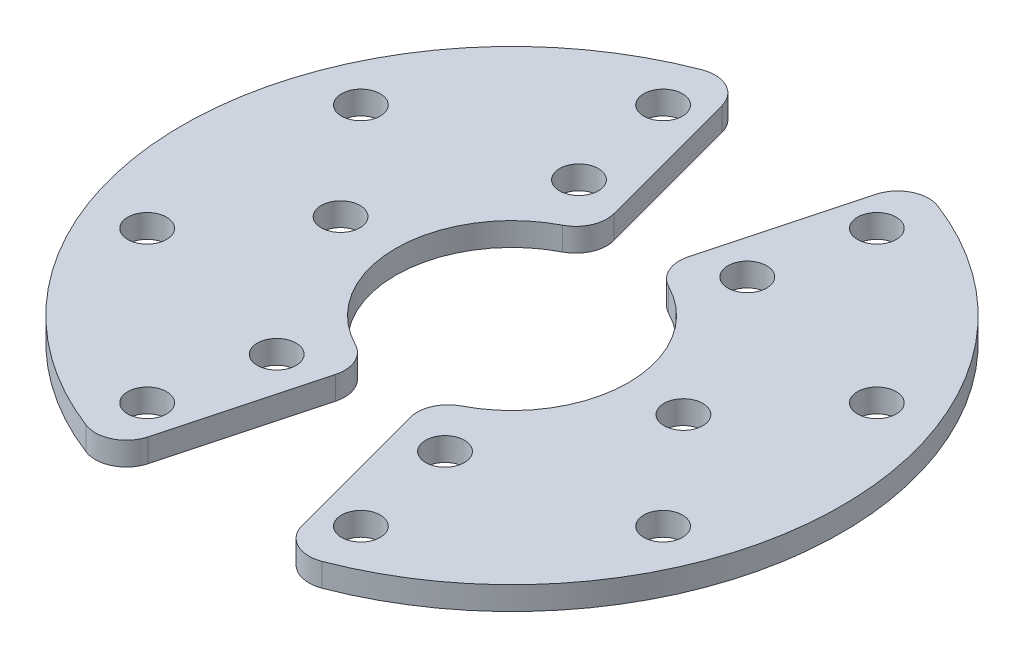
SolidWorks part; units mm, degrees
ref_plane "Front Plane" through (0, 0, 0) normal (0, 0, 1) x (1, 0, 0)
ref_plane "Top Plane" through (0, 0, 0) normal (0, 1, 0) x (1, 0, 0)
ref_plane "Right Plane" through (0, 0, 0) normal (1, 0, 0) x (0, 0, -1)
sketch "Sketch1" plane through (0, 0, 0) normal (0, 1, 0) x (1, 0, 0)
  line L0 (-13.7766, 33.2597) -> (0, 0) construction
  line L1 (0, 0) -> (0, 36) construction
  line L2 (-11.25, 19.4856) -> (-10.85, 19.4856) construction
  line L3 (-11.25, 21.9856) -> (-10.85, 21.9856)
  line L4 (-11.25, 16.9856) -> (-10.85, 16.9856)
  line L5 (-22.5, 0) -> (-22.1, 0) construction
  line L8 (-22.5, 2.5) -> (-22.1, 2.5)
  line L9 (-22.5, -2.5) -> (-22.1, -2.5)
  line L10 (-11.25, -19.4856) -> (-10.85, -19.4856) construction
  line L11 (-11.25, -16.9856) -> (-10.85, -16.9856)
  line L12 (-11.25, -21.9856) -> (-10.85, -21.9856)
  line L13 (0, -55) -> (0, 55) construction
  line L14 (11.25, -19.4856) -> (10.85, -19.4856) construction
  line L15 (11.25, -16.9856) -> (10.85, -16.9856)
  line L16 (11.25, -21.9856) -> (10.85, -21.9856)
  line L17 (22.5, 0) -> (22.1, 0) construction
  line L18 (22.5, 2.5) -> (22.1, 2.5)
  line L19 (22.5, -2.5) -> (22.1, -2.5)
  line L20 (11.25, 19.4856) -> (10.85, 19.4856) construction
  line L21 (11.25, 21.9856) -> (10.85, 21.9856)
  line L22 (11.25, 16.9856) -> (10.85, 16.9856)
  circle A0 centre (0, 0) radius 15
  circle A1 centre (0, 0) radius 42.5
  circle A2 centre (0, 0) radius 36 construction
  circle A3 centre (0, 0) radius 22.5 construction
  circle A4 centre (22.5, 0) radius 2.5 construction
  circle A5 centre (33.2597, -13.7766) radius 2.5
  circle A6 centre (11.25, -19.4856) radius 2.5 construction
  circle A7 centre (-11.25, -19.4856) radius 2.5 construction
  circle A8 centre (-22.5, 0) radius 2.5 construction
  circle A9 centre (-11.25, 19.4856) radius 2.5 construction
  circle A10 centre (11.25, 19.4856) radius 2.5 construction
  circle A11 centre (13.7766, -33.2597) radius 2.5
  circle A12 centre (-13.7766, -33.2597) radius 2.5
  circle A13 centre (-33.2597, -13.7766) radius 2.5
  circle A14 centre (-33.2597, 13.7766) radius 2.5
  circle A15 centre (-13.7766, 33.2597) radius 2.5
  circle A16 centre (13.7766, 33.2597) radius 2.5
  circle A17 centre (33.2597, 13.7766) radius 2.5
  arc A18 (-11.25, 21.9856) -> (-11.25, 16.9856) centre (-11.25, 19.4856) ccw
  arc A19 (-10.85, 16.9856) -> (-10.85, 21.9856) centre (-10.85, 19.4856) ccw
  arc A22 (-22.5, 2.5) -> (-22.5, -2.5) centre (-22.5, 0) ccw
  arc A23 (-22.1, -2.5) -> (-22.1, 2.5) centre (-22.1, 0) ccw
  arc A24 (-11.25, -16.9856) -> (-11.25, -21.9856) centre (-11.25, -19.4856) ccw
  arc A25 (-10.85, -21.9856) -> (-10.85, -16.9856) centre (-10.85, -19.4856) ccw
  arc A26 (11.25, -16.9856) -> (11.25, -21.9856) centre (11.25, -19.4856) cw
  arc A27 (10.85, -21.9856) -> (10.85, -16.9856) centre (10.85, -19.4856) cw
  arc A28 (22.5, 2.5) -> (22.5, -2.5) centre (22.5, 0) cw
  arc A29 (22.1, -2.5) -> (22.1, 2.5) centre (22.1, 0) cw
  arc A30 (11.25, 21.9856) -> (11.25, 16.9856) centre (11.25, 19.4856) cw
  arc A31 (10.85, 16.9856) -> (10.85, 21.9856) centre (10.85, 19.4856) cw
  circle A32 centre (-10.85, 19.4856) radius 2.5
  circle A33 centre (10.85, 19.4856) radius 2.5
  circle A34 centre (22.1, 0) radius 2.5
  circle A35 centre (10.85, -19.4856) radius 2.5
  circle A36 centre (-10.85, -19.4856) radius 2.5
  circle A37 centre (-22.1, 0) radius 2.5
  point P10 (-11.05, 19.4856)
  point P23 (0, 0)
  point P38 (0, 0)
  point P46 (-22.3, 0)
  point P56 (-11.05, -19.4856)
  point P67 (11.05, -19.4856)
  point P73 (22.3, 0)
  point P79 (11.05, 19.4856)
  dimension "D1" = 85
  dimension "D2" = 30
  dimension "D3" = 45
  dimension "D4" = 72
  dimension "D5" = 5
  dimension "D6" = 5
  dimension "D9" = 22.5
  dimension "D10" = 0.4
  dimension "D7" = 6
  dimension "D8" = 8
extrude "Boss-Extrude1" add sketch "Sketch1" along normal blind 3 contours A1 A25 L12 A24 L11 A23 L9 A22 L8 A19 L4 A18 L3 A17 A16 A15 A14 A13 A12 A11 A5 A0 L16 A27 L15 A26 L19 A29 L18 A28 L22 A31 L21 A30 | A37 L8 A22 L9 | A32 L3 A18 L4 | A33 L22 A30 L21 | A34 L19 A28 L18 | A35 L16 A26 L15 | A36 L11 A24 L12
sketch "Sketch2" plane through (0, 3, 0) normal (0, 1, 0) x (1, 0, 0)
  line L0 (-10.9998, 41.0518) -> (0, 0)
  line L1 (0, 0) -> (10.9998, 41.0518)
  line L3 (0, 0) -> (10.0775, 0) construction
  line L4 (0, 0) -> (10.9998, -41.0518)
  line L5 (-10.9998, -41.0518) -> (0, 0)
  circle A0 centre (0, 0) radius 42.5 construction
  arc A1 (-10.9998, -41.0518) -> (10.9998, -41.0518) centre (0, 0) ccw
  arc A2 (10.9998, 41.0518) -> (-10.9998, 41.0518) centre (0, 0) ccw
  dimension "D1" = 30
extrude "Cut-Extrude1" cut sketch "Sketch2" against normal blind 10
fillet "Fillet1" radius 4 4 edges at (-10.9998, 1.5, 41.0518) (-3.8823, 1.5, 14.4889) (-10.9998, 1.5, -41.0518) (-3.8823, 1.5, -14.4889)
fillet "Fillet2" radius 4 4 edges at (3.8823, 1.5, 14.4889) (10.9998, 1.5, 41.0518) (3.8823, 1.5, -14.4889) (10.9998, 1.5, -41.0518)
sketch "Sketch3" plane through (0, 3, 0) normal (0, 1, 0) x (1, 0, 0)
  line L2 (14.85, 13) -> (14.85, 7) construction
  line L3 (14.85, 13) -> (14.85, 7)
  line L4 (0, 0) -> (73.1548, 0) construction
  line L5 (0, 43.543) -> (0, -71.1557) construction
  line L6 (14.85, 13) -> (17.85, 13)
  line L7 (17.85, 13) -> (17.85, 7)
  line L8 (17.85, 7) -> (14.85, 7)
  line L12 (0, -43.543) -> (0, 71.1557) construction
  line L13 (17.85, -7) -> (14.85, -7)
  line L14 (17.85, -13) -> (17.85, -7)
  line L15 (14.85, -13) -> (17.85, -13)
  line L16 (14.85, -13) -> (14.85, -7)
  line L17 (-17.85, 7) -> (-14.85, 7)
  line L18 (-17.85, 13) -> (-17.85, 7)
  line L19 (-14.85, 13) -> (-17.85, 13)
  line L20 (-14.85, 13) -> (-14.85, 7)
  line L21 (-14.85, -13) -> (-14.85, -7)
  line L22 (-14.85, -13) -> (-17.85, -13)
  line L23 (-17.85, -13) -> (-17.85, -7)
  line L24 (-17.85, -7) -> (-14.85, -7)
  circle A0 centre (15.85, 13) radius 1
  circle A1 centre (17.85, 12) radius 1
  circle A2 centre (15.85, 7) radius 1
  circle A3 centre (17.85, 8) radius 1
  circle A4 centre (17.85, -8) radius 1
  circle A5 centre (15.85, -7) radius 1
  circle A6 centre (17.85, -12) radius 1
  circle A7 centre (15.85, -13) radius 1
  circle A8 centre (-17.85, 8) radius 1
  circle A9 centre (-15.85, 7) radius 1
  circle A10 centre (-17.85, 12) radius 1
  circle A11 centre (-15.85, 13) radius 1
  circle A12 centre (-15.85, -13) radius 1
  circle A13 centre (-17.85, -12) radius 1
  circle A14 centre (-15.85, -7) radius 1
  circle A15 centre (-17.85, -8) radius 1
  dimension "D2" = 2
  dimension "D1" = 3
extrude "Cut-Extrude2" [suppressed] cut sketch "Sketch3" against normal through all contours L7 A1 | L7 A1 | L6 A0 | L6 A0 | A3 L7 A1 L6 A0 L3 A2 L8 | L8 A2 | L8 A2 | L7 A3 | L7 A3 | L16 A7 L15 A6 L14 A4 L13 A5 | A5 L13 | A5 L13 | A4 L14 | A6 L14 | A6 L14 | A7 L15 | A7 L15 | A15 L23 A13 L22 A12 L21 A14 L24 | L23 A15 | L23 A15 | L24 A14 | L23 A13 | L23 A13 | L22 A12 | L22 A12 | L24 A14 | L20 A11 L19 A10 L18 A8 L17 A9 | A11 L19 | A11 L19 | A10 L18 | A10 L18 | A8 L18 | A8 L18 | A9 L17 | A9 L17
